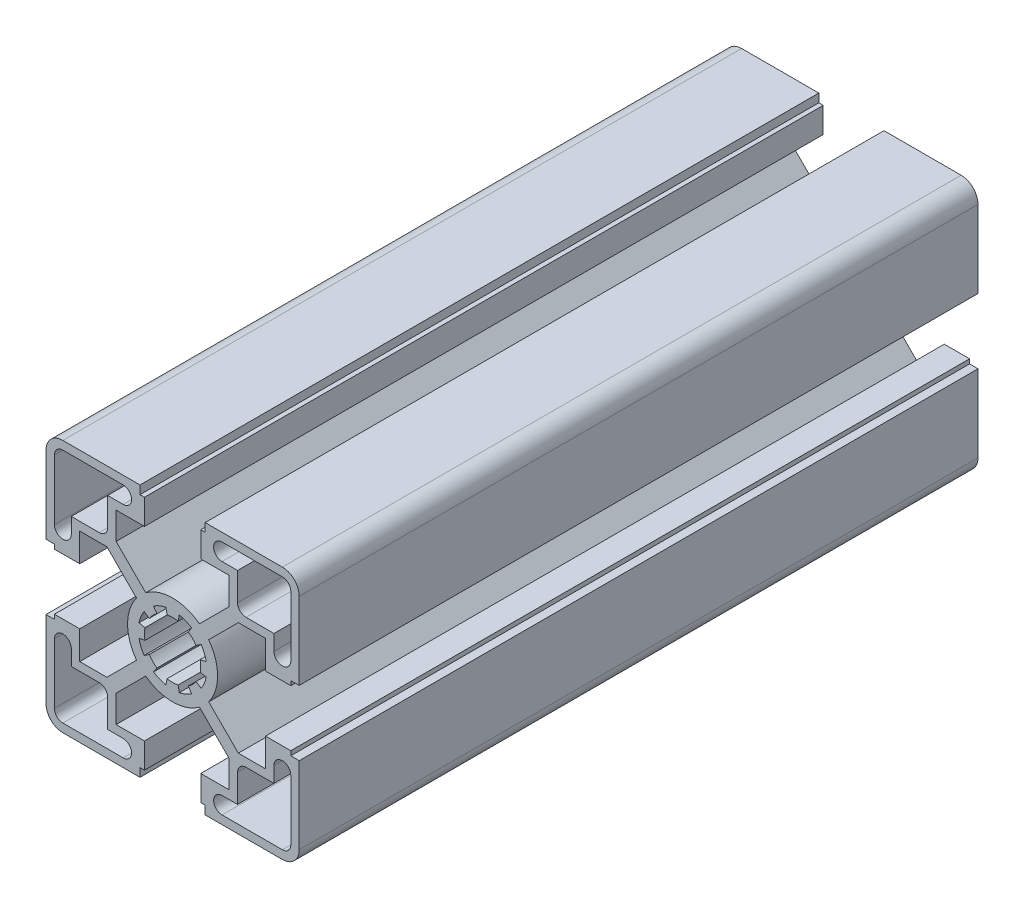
SolidWorks part; units mm, degrees
ref_plane "Front Plane" through (0, 0, 0) normal (0, 0, 1) x (1, 0, 0)
ref_plane "Top Plane" through (0, 0, 0) normal (0, 1, 0) x (1, 0, 0)
ref_plane "Right Plane" through (0, 0, 0) normal (1, 0, 0) x (0, 0, -1)
sketch "Sketch1" plane through (0, 0, 0) normal (0, 0, 1) x (1, 0, 0)
  line L2 (-19.5072, 22.5044) -> (-5.7912, 22.5044)
  line L3 (-5.7912, 22.5044) -> (-5.7912, 21.0058)
  line L4 (-5.7912, 21.0058) -> (-5.0038, 21.0058)
  line L6 (-5.0038, 21.0058) -> (-5.0038, 16.51)
  line L7 (-5.0038, 16.51) -> (-10.0457, 16.51)
  line L8 (-10.0457, 16.51) -> (-10.0457, 11.6801)
  line L9 (-10.0457, 11.6801) -> (-4.781, 6.4154)
  line L11 (-11.6801, 10.0457) -> (-6.4154, 4.781)
  line L12 (-16.51, 10.0457) -> (-11.6801, 10.0457)
  line L13 (-16.51, 5.0038) -> (-16.51, 10.0457)
  line L14 (-21.0058, 5.0038) -> (-16.51, 5.0038)
  line L15 (-21.0058, 5.7912) -> (-21.0058, 5.0038)
  line L16 (-22.5044, 5.7912) -> (-21.0058, 5.7912)
  line L17 (-22.5044, 19.5072) -> (-22.5044, 5.7912)
  line L18 (-18.0086, 11.5443) -> (-13.0429, 11.5443)
  line L19 (-18.0086, 11.5443) -> (-18.0086, 8.7884)
  line L20 (-11.5443, 18.0086) -> (-11.5443, 13.0429)
  line L21 (-21.0058, 19.5072) -> (-21.0058, 8.7884)
  line L23 (-11.5443, 18.0086) -> (-8.7884, 18.0086)
  line L24 (-19.5072, 21.0058) -> (-8.7884, 21.0058)
  line L25 (1.1893, 5.9789) -> (0.9762, 4.9077)
  line L26 (-1.1893, 5.9789) -> (-0.9762, 4.9077)
  line L27 (5.0686, 3.3868) -> (4.1605, 2.78)
  line L28 (3.3868, 5.0686) -> (2.78, 4.1605)
  line L29 (5.9789, -1.1893) -> (4.9077, -0.9762)
  line L30 (5.9789, 1.1893) -> (4.9077, 0.9762)
  line L31 (3.3868, -5.0686) -> (2.78, -4.1605)
  line L32 (5.0686, -3.3868) -> (4.1605, -2.78)
  line L33 (-1.1893, -5.9789) -> (-0.9762, -4.9077)
  line L34 (1.1893, -5.9789) -> (0.9762, -4.9077)
  line L35 (-5.0686, -3.3868) -> (-4.1605, -2.78)
  line L36 (-3.3868, -5.0686) -> (-2.78, -4.1605)
  line L37 (-5.9789, 1.1893) -> (-4.9077, 0.9762)
  line L38 (-5.9789, -1.1893) -> (-4.9077, -0.9762)
  line L39 (-3.3868, 5.0686) -> (-2.78, 4.1605)
  line L40 (-5.0686, 3.3868) -> (-4.1605, 2.78)
  line L41 (11.5443, 18.0086) -> (8.7884, 18.0086)
  line L42 (19.5072, 21.0058) -> (8.7884, 21.0058)
  line L43 (19.5072, 22.5044) -> (5.7912, 22.5044)
  line L44 (5.7912, 22.5044) -> (5.7912, 21.0058)
  line L45 (5.7912, 21.0058) -> (5.0038, 21.0058)
  line L46 (5.0038, 21.0058) -> (5.0038, 16.51)
  line L47 (5.0038, 16.51) -> (10.0457, 16.51)
  line L48 (10.0457, 16.51) -> (10.0457, 11.6801)
  line L49 (10.0457, 11.6801) -> (4.781, 6.4154)
  line L50 (11.6801, 10.0457) -> (6.4154, 4.781)
  line L51 (21.0058, 19.5072) -> (21.0058, 8.7884)
  line L52 (11.5443, 18.0086) -> (11.5443, 13.0429)
  line L53 (18.0086, 11.5443) -> (18.0086, 8.7884)
  line L54 (18.0086, 11.5443) -> (13.0429, 11.5443)
  line L55 (22.5044, 19.5072) -> (22.5044, 5.7912)
  line L56 (22.5044, 5.7912) -> (21.0058, 5.7912)
  line L57 (21.0058, 5.7912) -> (21.0058, 5.0038)
  line L58 (21.0058, 5.0038) -> (16.51, 5.0038)
  line L59 (16.51, 5.0038) -> (16.51, 10.0457)
  line L60 (16.51, 10.0457) -> (11.6801, 10.0457)
  line L61 (16.51, -10.0457) -> (11.6801, -10.0457)
  line L62 (16.51, -5.0038) -> (16.51, -10.0457)
  line L63 (21.0058, -5.0038) -> (16.51, -5.0038)
  line L64 (21.0058, -5.7912) -> (21.0058, -5.0038)
  line L65 (22.5044, -5.7912) -> (21.0058, -5.7912)
  line L66 (22.5044, -19.5072) -> (22.5044, -5.7912)
  line L67 (18.0086, -11.5443) -> (13.0429, -11.5443)
  line L68 (18.0086, -11.5443) -> (18.0086, -8.7884)
  line L69 (11.5443, -18.0086) -> (11.5443, -13.0429)
  line L70 (21.0058, -19.5072) -> (21.0058, -8.7884)
  line L71 (11.6801, -10.0457) -> (6.4154, -4.781)
  line L72 (10.0457, -11.6801) -> (4.781, -6.4154)
  line L73 (10.0457, -16.51) -> (10.0457, -11.6801)
  line L74 (5.0038, -16.51) -> (10.0457, -16.51)
  line L75 (5.0038, -21.0058) -> (5.0038, -16.51)
  line L76 (5.7912, -21.0058) -> (5.0038, -21.0058)
  line L77 (5.7912, -22.5044) -> (5.7912, -21.0058)
  line L78 (19.5072, -22.5044) -> (5.7912, -22.5044)
  line L79 (19.5072, -21.0058) -> (8.7884, -21.0058)
  line L80 (11.5443, -18.0086) -> (8.7884, -18.0086)
  line L81 (-11.5443, -18.0086) -> (-8.7884, -18.0086)
  line L82 (-19.5072, -21.0058) -> (-8.7884, -21.0058)
  line L83 (-19.5072, -22.5044) -> (-5.7912, -22.5044)
  line L84 (-5.7912, -22.5044) -> (-5.7912, -21.0058)
  line L85 (-5.7912, -21.0058) -> (-5.0038, -21.0058)
  line L86 (-5.0038, -21.0058) -> (-5.0038, -16.51)
  line L87 (-5.0038, -16.51) -> (-10.0457, -16.51)
  line L88 (-10.0457, -16.51) -> (-10.0457, -11.6801)
  line L89 (-10.0457, -11.6801) -> (-4.781, -6.4154)
  line L90 (-11.6801, -10.0457) -> (-6.4154, -4.781)
  line L91 (-21.0058, -19.5072) -> (-21.0058, -8.7884)
  line L92 (-11.5443, -18.0086) -> (-11.5443, -13.0429)
  line L93 (-18.0086, -11.5443) -> (-18.0086, -8.7884)
  line L94 (-18.0086, -11.5443) -> (-13.0429, -11.5443)
  line L95 (-22.5044, -19.5072) -> (-22.5044, -5.7912)
  line L96 (-22.5044, -5.7912) -> (-21.0058, -5.7912)
  line L97 (-21.0058, -5.7912) -> (-21.0058, -5.0038)
  line L98 (-21.0058, -5.0038) -> (-16.51, -5.0038)
  line L99 (-16.51, -5.0038) -> (-16.51, -10.0457)
  line L100 (-16.51, -10.0457) -> (-11.6801, -10.0457)
  arc A0 (-22.5044, 19.5072) -> (-19.5072, 22.5044) centre (-19.5072, 19.5072) cw
  arc A1 (-21.0058, 8.7884) -> (-18.0086, 8.7884) centre (-19.5072, 8.7884) ccw
  arc A2 (-21.0058, 19.5072) -> (-19.5072, 21.0058) centre (-19.5072, 19.5072) cw
  arc A3 (-8.7884, 21.0058) -> (-8.7884, 18.0086) centre (-8.7884, 19.5072) cw
  arc A4 (-11.5443, 13.0429) -> (-13.0429, 11.5443) centre (-13.0429, 13.0429) cw
  arc A5 (6.4154, -4.781) -> (6.4154, 4.781) centre (0, 0) ccw
  arc A6 (0.9762, 4.9077) -> (-0.9762, 4.9077) centre (0, 0) ccw
  arc A7 (-5.0686, 3.3868) -> (-5.9789, 1.1893) centre (0, 0) ccw
  arc A8 (4.1605, 2.78) -> (2.78, 4.1605) centre (0, 0) ccw
  arc A9 (4.9077, -0.9762) -> (4.9077, 0.9762) centre (0, 0) ccw
  arc A10 (2.78, -4.1605) -> (4.1605, -2.78) centre (0, 0) ccw
  arc A11 (-0.9762, -4.9077) -> (0.9762, -4.9077) centre (0, 0) ccw
  arc A12 (-4.1605, -2.78) -> (-2.78, -4.1605) centre (0, 0) ccw
  arc A13 (-4.9077, 0.9762) -> (-4.9077, -0.9762) centre (0, 0) ccw
  arc A14 (-2.78, 4.1605) -> (-4.1605, 2.78) centre (0, 0) ccw
  arc A15 (-5.9789, -1.1893) -> (-5.0686, -3.3868) centre (0, 0) ccw
  arc A16 (-3.3868, -5.0686) -> (-1.1893, -5.9789) centre (0, 0) ccw
  arc A17 (1.1893, -5.9789) -> (3.3868, -5.0686) centre (0, 0) ccw
  arc A18 (5.0686, -3.3868) -> (5.9789, -1.1893) centre (0, 0) ccw
  arc A19 (5.9789, 1.1893) -> (5.0686, 3.3868) centre (0, 0) ccw
  arc A20 (3.3868, 5.0686) -> (1.1893, 5.9789) centre (0, 0) ccw
  arc A21 (-1.1893, 5.9789) -> (-3.3868, 5.0686) centre (0, 0) ccw
  arc A22 (8.7884, 21.0058) -> (8.7884, 18.0086) centre (8.7884, 19.5072) ccw
  arc A23 (21.0058, 19.5072) -> (19.5072, 21.0058) centre (19.5072, 19.5072) ccw
  arc A24 (22.5044, 19.5072) -> (19.5072, 22.5044) centre (19.5072, 19.5072) ccw
  arc A25 (11.5443, 13.0429) -> (13.0429, 11.5443) centre (13.0429, 13.0429) ccw
  arc A26 (21.0058, 8.7884) -> (18.0086, 8.7884) centre (19.5072, 8.7884) cw
  arc A27 (21.0058, -8.7884) -> (18.0086, -8.7884) centre (19.5072, -8.7884) ccw
  arc A28 (11.5443, -13.0429) -> (13.0429, -11.5443) centre (13.0429, -13.0429) cw
  arc A29 (22.5044, -19.5072) -> (19.5072, -22.5044) centre (19.5072, -19.5072) cw
  arc A30 (21.0058, -19.5072) -> (19.5072, -21.0058) centre (19.5072, -19.5072) cw
  arc A31 (8.7884, -21.0058) -> (8.7884, -18.0086) centre (8.7884, -19.5072) cw
  arc A32 (-8.7884, -21.0058) -> (-8.7884, -18.0086) centre (-8.7884, -19.5072) ccw
  arc A33 (-21.0058, -19.5072) -> (-19.5072, -21.0058) centre (-19.5072, -19.5072) ccw
  arc A34 (-22.5044, -19.5072) -> (-19.5072, -22.5044) centre (-19.5072, -19.5072) ccw
  arc A35 (-11.5443, -13.0429) -> (-13.0429, -11.5443) centre (-13.0429, -13.0429) ccw
  arc A36 (-21.0058, -8.7884) -> (-18.0086, -8.7884) centre (-19.5072, -8.7884) cw
  arc A37 (4.781, 6.4154) -> (-4.781, 6.4154) centre (0, 0) ccw
  arc A38 (-4.781, -6.4154) -> (4.781, -6.4154) centre (0, 0) ccw
  arc A39 (-6.4154, 4.781) -> (-6.4154, -4.781) centre (0, 0) ccw
extrude "Boss-Extrude1" add sketch "Sketch1" along normal mid plane 120.65
